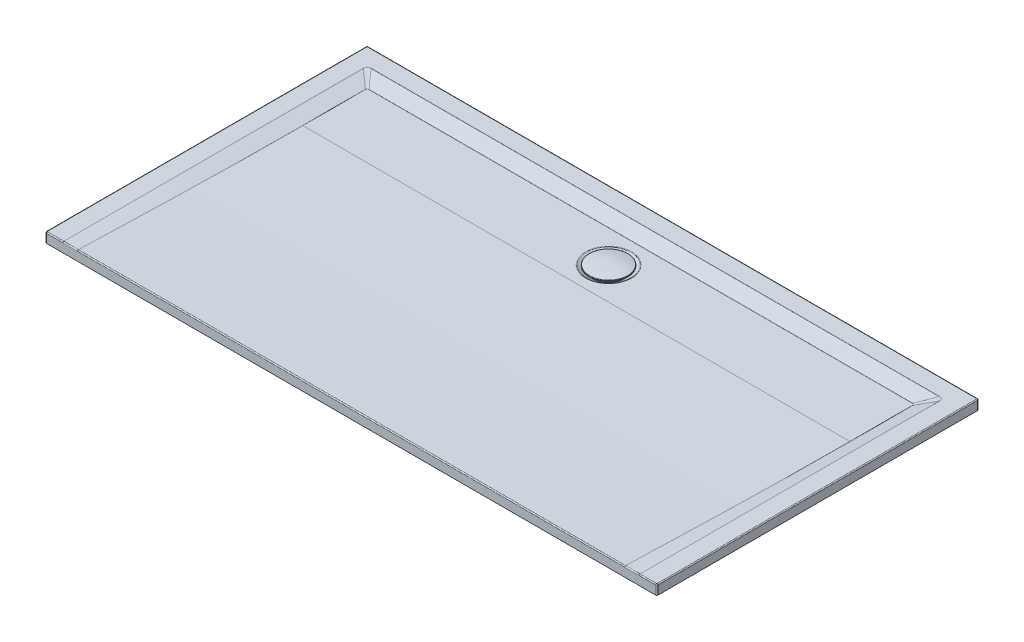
SolidWorks part; units mm, degrees
ref_plane "Płaszczyzna przednia" through (0, 0, 0) normal (0, 0, 1) x (1, 0, 0)
ref_plane "Płaszczyzna górna" through (0, 0, 0) normal (0, 1, 0) x (1, 0, 0)
ref_plane "Płaszczyzna prawa" through (0, 0, 0) normal (1, 0, 0) x (0, 0, -1)
sketch "Szkic1" plane through (0, 0, 0) normal (0, 1, 0) x (1, 0, 0)
  line L0 (0, 500) -> (0, -500) construction
  line L1 (-950, 500) -> (950, 500)
  line L2 (-950, 500) -> (-950, -500)
  line L3 (-950, -500) -> (950, -500)
  line L4 (950, 500) -> (950, -500)
  line L5 (-895, -500) -> (-895, 445)
  line L6 (-895, 445) -> (895, 445)
  line L7 (895, 445) -> (895, -500)
  line L8 (-850, -500) -> (-850, 400)
  line L9 (-850, 400) -> (850, 400)
  line L10 (850, 400) -> (850, -500)
  circle A0 centre (0, 300) radius 45
  circle A1 centre (0, 300) radius 70
  point P9 (0, 445)
  dimension "D6" = 90
  dimension "D7" = 140
  dimension "D1" = 1900
  dimension "D2" = 55
  dimension "D3" = 55
  dimension "D5" = 200
  dimension "D8" = 1000
  dimension "D4" = 45
sketch "Szkic2" plane through (0, 0, 0) normal (0, 1, 0) x (1, 0, 0)
  line L0 (-950, -500) -> (950, -500) construction
  line L1 (950, 500) -> (950, -500) construction
  line L2 (895, 445) -> (895, -500) construction
  line L3 (-895, 445) -> (895, 445) construction
  line L4 (-950, 500) -> (950, 500) construction
  line L5 (-895, -500) -> (-895, 445) construction
  line L6 (-950, 500) -> (-950, -500) construction
  line L7 (-950, -500) -> (-895, -500)
  line L8 (950, 500) -> (950, -500)
  line L9 (895, 445) -> (895, -500)
  line L10 (-895, 445) -> (895, 445)
  line L11 (-950, 500) -> (950, 500)
  line L12 (-895, -500) -> (-895, 445)
  line L13 (-950, 500) -> (-950, -500)
  line L14 (895, -500) -> (950, -500)
surface "Powierzchnia-Płaszczyzna1" sketch "Szkic2"
ref_plane "Płaszczyzna1" through (0, -15, 0) normal (0, 1, 0) x (-1, 0, 0)
sketch "Szkic3" plane through (0, -15, 0) normal (0, 1, 0) x (-1, 0, 0)
  line L0 (850, -200) -> (-850, -200)
  line L1 (850, 500) -> (850, -400) construction
  line L2 (-850, -400) -> (-850, 500) construction
  line L3 (0, -200) -> (0, -400) construction
  line L4 (850, -400) -> (-850, -400) construction
  line L5 (-850, -400) -> (-850, -200)
  line L6 (850, -200) -> (850, -400)
  line L7 (850, -400) -> (-850, -400)
  circle A0 centre (0, -300) radius 70 construction
  circle A1 centre (0, -300) radius 70
  point P10 (0, -300)
surface "Powierzchnia-Płaszczyzna2" sketch "Szkic3"
sketch "Szkic4" plane through (0, 0, 0) normal (0, 1, 0) x (1, 0, 0)
  line L0 (850, -500) -> (-850, -500)
other "Granica-Powierzchnia1"
other "Granica-Powierzchnia2"
other "Granica-Powierzchnia3"
mirror "Lustro1" about plane through (0, 0, 0) normal (1, 0, 0)
sketch "Szkic5" plane through (0, 0, 0) normal (0, 1, 0) x (1, 0, 0)
  line L0 (950, 500) -> (950, -500) construction
  line L1 (-950, 500) -> (950, 500) construction
  line L2 (-950, 500) -> (-950, -500) construction
  line L3 (-950, -500) -> (950, -500) construction
  line L4 (950, 500) -> (950, -500)
  line L5 (-950, 500) -> (950, 500)
  line L6 (-950, 500) -> (-950, -500)
  line L7 (-950, -500) -> (950, -500)
surface "Powierzchnia-Wyciągnięcie1" sketch "Szkic5" parameters "D1"=30
sketch "Szkic7" plane through (0, 0, 0) normal (1, 0, 0) x (0, 0, -1)
  line L0 (300, 0) -> (300, -30) construction
  line L1 (500, -30) -> (-500, -30) construction
  line L2 (345, -30) -> (345, -28)
  line L3 (345, -28) -> (349, -28)
  line L6 (349, -28) -> (370, -15)
  dimension "D1" = 90
  dimension "D2" = 2
  dimension "D3" = 98
surface "Powierzchnia-Obrót wokół linii środkowej1" sketch "Szkic7" parameters "D1"=360
surface "Powierzchnia-Płaszczyzna3"
surface "Powierzchnia-Połącz1"
fillet "Zaokrąglenie1" radius 4 6 edges at (0, -28, -349) (0, -15, -230) (950, -15, 500) (950, -15, -500) (-950, -15, -500) (-950, -15, 500)
fillet "Zmienne zaokrąglenie1" radius 40 2 edges at (872.5, -7.5, -422.5)
fillet "Zaokrąglenie3" radius 3 12 edges
fillet "Zaokrąglenie4" radius 3 12 edges at (-948.8284, 0, -498.8284) (0, 0, -500) (948.8284, 0, -498.8284) (950, 0, 0) (948.8284, 0, 498.8284) (920.5, 0, 500) (-920.5, 0, 500) (-948.8284, 0, 498.8284) (-950, 0, 0)
sketch "Szkic8" plane through (0, 0, 0) normal (1, 0, 0) x (0, 0, -1)
  line L0 (300, 0) -> (300, -30) construction
  line L1 (300, -5.6601) -> (179.8469, -5.6601) construction
  line L2 (360, -14.7573) -> (360, -17)
  line L3 (360, -17) -> (300, -17)
  line L4 (300, -17) -> (300, -5.6601)
  line L5 (300, -5.6601) -> (199.9922, 95.6514)
  arc A0 (300, -5.6601) -> (359.2694, -13.7943) centre (300, -225.6601) cw
  arc A1 (359.2694, -13.7943) -> (360, -14.7573) centre (359, -14.7573) cw
  point P11 (360, -14)
  dimension "D1" = 220
  dimension "D4" = 1
  dimension "D2" = 60
  dimension "D3" = 3
  dimension "D5" = 13
revolve "Obrót wokół linii środkowej1" add sketch "Szkic8" angle 360 about L4
